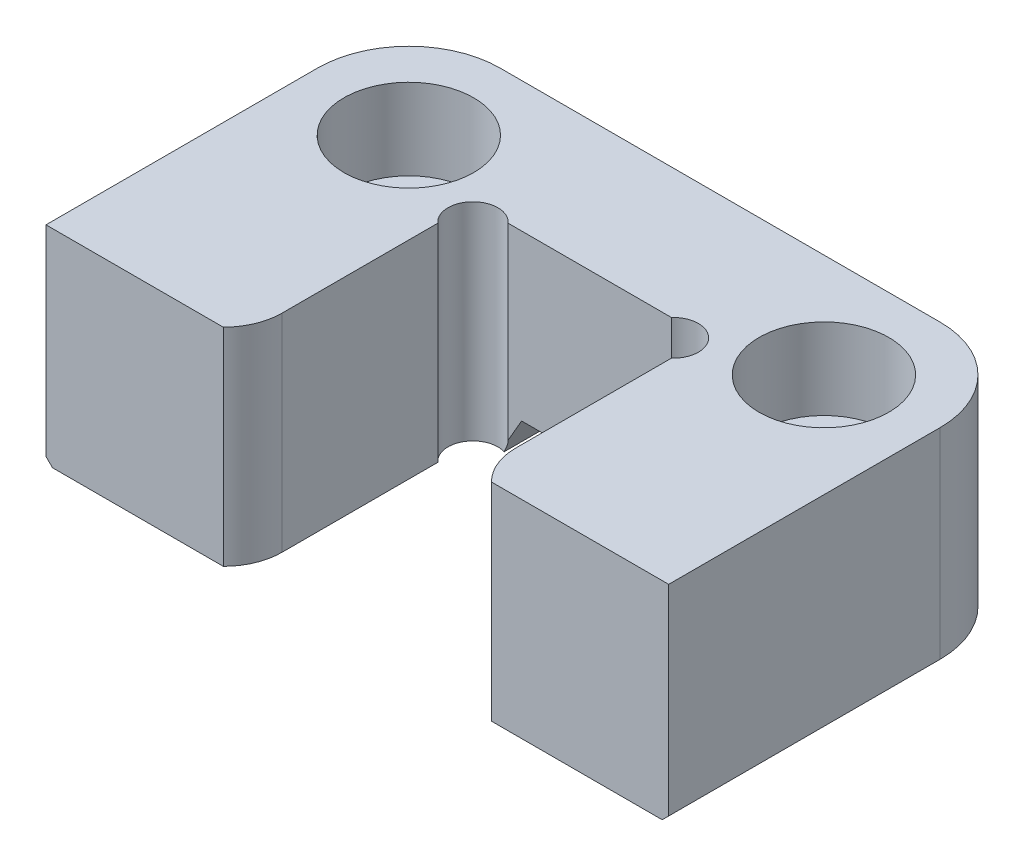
SolidWorks part; units mm, degrees
ref_plane "Front Plane" through (0, 0, 0) normal (0, 0, 1) x (1, 0, 0)
ref_plane "Top Plane" through (0, 0, 0) normal (0, 1, 0) x (1, 0, 0)
ref_plane "Right Plane" through (0, 0, 0) normal (1, 0, 0) x (0, 0, -1)
sketch "Sketch1" plane through (0, 0, 0) normal (0, 1, 0) x (1, 0, 0)
  line L0 (0, 0) -> (0, 50000) construction
  line L1 (0, 0) -> (50000, 0) construction
  line L2 (7.1501, 0) -> (19.05, 0)
  line L3 (-19.05, 0) -> (-7.1501, 0)
  line L4 (-19.05, 0) -> (-19.05, 22.1996)
  line L5 (-19.05, 22.1996) -> (19.05, 22.1996)
  line L6 (19.05, 0) -> (19.05, 22.1996)
  line L8 (-7.1501, 0) -> (-7.1501, 14.224)
  line L9 (-7.1501, 14.224) -> (7.1501, 14.224)
  line L10 (7.1501, 0) -> (7.1501, 14.224)
  dimension "D1" = 22.1996
  dimension "D2" = 38.1
  dimension "D3" = 14.3002
  dimension "D4" = 14.224
extrude "Boss-Extrude1" add sketch "Sketch1" against normal blind 12.6746 separate body
fillet "Fillet1" radius 5.588 2 edges at (19.05, -6.3373, -22.1996) (-19.05, -6.3373, -22.1996)
sketch "Sketch2" plane through (0, 0, 0) normal (0, 1, 0) x (1, 0, 0)
  line L0 (0, 0) -> (0, 50000) construction
  line L1 (-7.1501, 0) -> (-7.1501, 14.224) construction
  line L2 (-19.05, 0) -> (-7.1501, 0) construction
  line L3 (-7.1501, 2.54) -> (-7.1501, 12.7)
  line L4 (-13.5001, 0) -> (-8.2025, 0)
  line L5 (13.5001, 0) -> (13.5001, -12.7)
  line L6 (-13.5001, -12.7) -> (13.5001, -12.7)
  line L7 (-7.1501, 12.7) -> (7.1501, 12.7)
  line L8 (-13.5001, 0) -> (-13.5001, -12.7)
  line L9 (13.5001, 0) -> (8.2025, 0)
  line L10 (7.1501, 2.54) -> (7.1501, 12.7)
  arc A0 (-7.4801, 0.5195) -> (-8.2025, 0) centre (-8.2025, 0.762) cw construction
  arc A1 (7.4801, 0.5195) -> (7.1501, 2.54) centre (13.5001, 2.54) cw construction
  arc A2 (-7.4801, 0.5195) -> (-7.1501, 2.54) centre (-13.5001, 2.54) ccw construction
  arc A3 (7.4801, 0.5195) -> (8.2025, 0) centre (8.2025, 0.762) ccw construction
  arc A4 (8.2025, 0) -> (7.1501, 2.54) centre (10.7415, 2.54) cw
  arc A5 (-8.2025, 0) -> (-7.1501, 2.54) centre (-10.7415, 2.54) ccw
  point P14 (0, -12.7)
  point P24 (0, 12.7)
  dimension "D1" = 0.762
  dimension "D2" = 6.35
  dimension "D3" = 2.54
  dimension "D4" = 12.7
  dimension "D5" = 12.7
extrude "Cut-Extrude1" cut sketch "Sketch2" against normal through all
sketch "Sketch3" plane through (0, 0, 0) normal (0, 1, 0) x (1, 0, 0)
  line L2 (-7.6581, 2.54) -> (-7.6581, 14.224)
  line L3 (-7.6581, 2.54) -> (-7.6581, 14.224) construction
  line L4 (0, 0) -> (0, 50000) construction
  line L5 (-7.1501, 14.732) -> (7.1501, 14.732)
  line L6 (-7.1501, 14.732) -> (7.1501, 14.732) construction
  circle A0 centre (-6.1341, 13.208) radius 1.524
  circle A1 centre (6.1341, 13.208) radius 1.524
  dimension "D3" = 1.524
  dimension "D1" = 0.508
  dimension "D2" = 0.508
extrude "Cut-Extrude2" cut sketch "Sketch3" against normal through all
sketch "Sketch5" plane through (0, 0, -22.1996) normal (0, 0, -1) x (-1, 0, 0)
  line L0 (-4.7625, -11.0871) -> (4.7625, -11.0871)
  line L1 (-13.462, 0) -> (13.462, 0) construction
  line L2 (0, 0) -> (0, 50000) construction
  line L3 (4.7625, -11.0871) -> (5.679, -12.6746)
  line L4 (-13.462, -12.6746) -> (13.462, -12.6746) construction
  line L5 (-5.679, -12.6746) -> (5.679, -12.6746)
  line L6 (-4.7625, -11.0871) -> (-5.679, -12.6746)
  point P4 (0, 0)
  point P12 (0, -12.6746)
  point P13 (0, -11.0871)
  dimension "D1" = 30
  dimension "D2" = 1.5875
  dimension "D3" = 9.525
extrude "Cut-Extrude3" cut sketch "Sketch5" against normal through all
chamfer "Chamfer1" distance 0.3969 angle 45 6 edges at (9.5705, -12.6746, -22.1996) (17.4133, -12.6746, -20.5629) (19.05, -12.6746, -8.3058) (-9.5705, -12.6746, -22.1996) (-17.4133, -12.6746, -20.5629) (-19.05, -12.6746, -8.3058)
chamfer "Chamfer5" distance 3.81 angle 15 1 edges at (0, -11.0871, -14.224)
hole_wizard "#8 CBORE" positions "Sketch7" profile "Sketch6" counterbore size "#8" standard "Ansi Inch"
sketch "Sketch7" plane through (9.0831, 0, -5.226) normal (0, 1, 0) x (-1, 0, 0)
  line L0 (9.0831, 0) -> (9.0831, 50000) construction
  line L1 (-4.3789, -16.9736) -> (22.5451, -16.9736) construction
  line L2 (28.1331, -11.3856) -> (28.1331, 5.226) construction
  point P0 (21.7831, -10.6236)
  point P11 (-3.6169, -10.6236)
  dimension "D1" = 6.35
  dimension "D2" = 6.35
sketch "Sketch6" plane through (-12.7, 0, -15.8496) normal (1, 0, 0) x (0, 0, 1)
  line L0 (0, 0) -> (0, 12.6746)
  line L1 (0, 12.6746) -> (2.2479, 12.6746)
  line L3 (2.2479, 12.6746) -> (2.2479, 4.9606)
  line L4 (2.2479, 4.9606) -> (3.9687, 4.9606)
  line L5 (3.9687, 4.9606) -> (3.9687, 0)
  line L7 (3.9687, 0) -> (0, 0)
  line L11 (0, -6.35) -> (0, 107.95) construction
  dimension "Thru Hole Dia." = 4.4958
  dimension "Thru Hole Depth" = 12.6746
  dimension "C'Bore Dia." = 7.9375
  dimension "C'Bore Depth" = 4.9606
